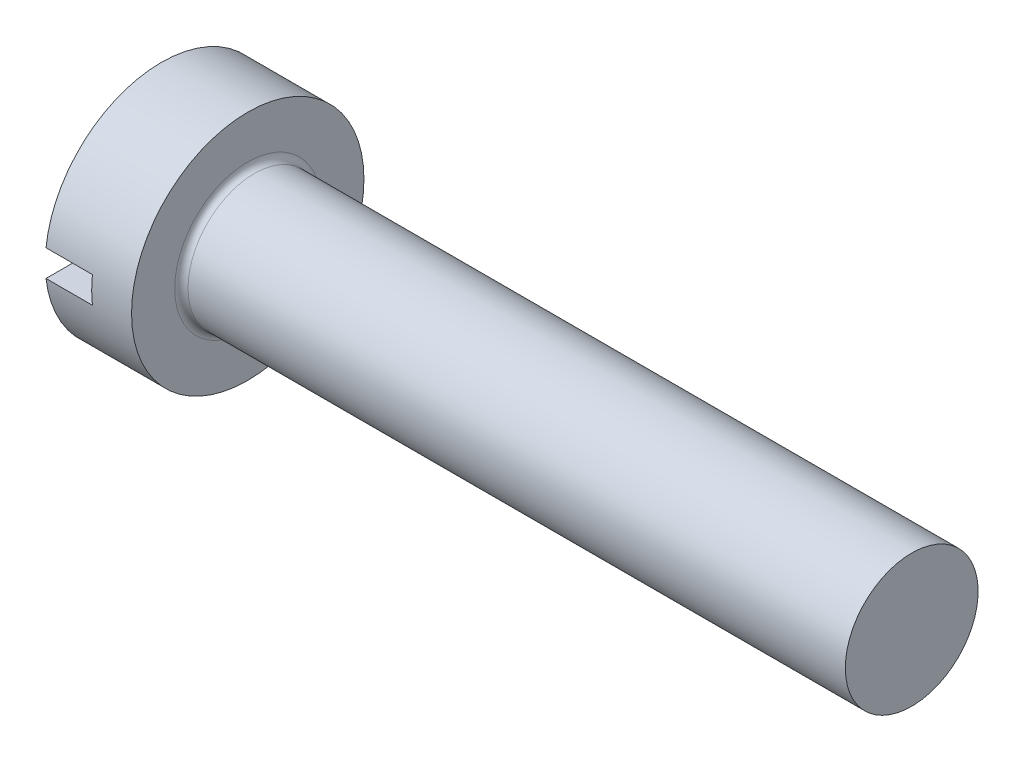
SolidWorks part; units mm, degrees
ref_plane "Front Plane" through (0, 0, 0) normal (0, 0, 1) x (1, 0, 0)
ref_plane "Top Plane" through (0, 0, 0) normal (0, 1, 0) x (1, 0, 0)
ref_plane "Right Plane" through (0, 0, 0) normal (1, 0, 0) x (0, 0, -1)
sketch "BodySke" plane through (0, 0, 0) normal (0, 0, 1) x (1, 0, 0)
  line L0 (0, 0) -> (120.5141, 0) construction
  line L1 (0, 0) -> (0, 50.5629) construction
  line L2 (5.2, 7) -> (5.2, 4)
  line L3 (5.2, 4) -> (45.2, 4)
  line L4 (45.2, 4) -> (45.2, 0)
  line L5 (0, 0) -> (45.2, 0)
  line L6 (5.2, 7) -> (0, 7)
  line L7 (6.45, 10.4217) -> (6.45, -3.1786) construction
  line L8 (15.2, 9.5609) -> (15.2, -6.7938) construction
  line L9 (0, 7) -> (0, 0)
  point P14 (45.2, 3.3095)
  dimension "Diameter" = 8
  dimension "Head_height" = 5.2
  dimension "Length" = 40
  dimension "Head_dia" = 14
  dimension "Advance" = 1.25
  dimension "Thread_length" = 30
  dimension "Thread_minor" = 6.619
revolve "BaseBody" add sketch "BodySke" angle 360 about L0
fillet "Fillet1" radius 0.4 1 edges at (5.2, 0, 4)
sketch "SlotSke" plane through (0, 0, 0) normal (1, 0, 0) x (0, 0, -1)
  line L1 (7, 0.8) -> (-7, 0.8)
  line L2 (7, 0.8) -> (7, -0.8)
  line L3 (7, -0.8) -> (-7, -0.8)
  line L4 (-7, 0.8) -> (-7, -0.8)
  dimension "D1" = 14
  dimension "D2" = 7
  dimension "Slot_width" = 1.6
  dimension "D4" = 0.8
extrude "Slot" cut sketch "SlotSke" along normal blind 2.8
sketch "ThdSchSke" plane through (0, 0, 0) normal (0, 0, 1) x (1, 0, 0)
  line L0 (0, 0) -> (54.7976, 0) construction
  line L1 (44.8013, 4.7973) -> (44.8013, 4)
  line L2 (44.8013, 4.7973) -> (45.5987, 4.7973)
  line L3 (45.5987, 4.7973) -> (45.5987, 4)
  line L4 (45.5987, 4) -> (45.2, 3.3095)
  line L5 (45.2, 3.3095) -> (44.8013, 4)
  line L6 (5.2, 4) -> (45.2, 4) construction
revolve "ThreadSchematic" [suppressed] cut sketch "ThdSchSke" angle 360 about L0
pattern_linear "ThdSchPat" [suppressed] count 24 along (1, 0, 0)
equation "\"Thread_minor@ThreadCosmetic\" = \"Thread_minor@BodySke\""
equation "\"D1@SlotSke\" = \"Head_dia@BodySke\""
equation "\"D2@SlotSke\" = \"D1@SlotSke\" / 2"
equation "\"D4@SlotSke\" = \"Slot_width@SlotSke\" / 2"
equation "\"Advance@ThdSchPat\" = \"Advance@BodySke\""
equation "\"D1@ThdSchPat\" =  int( \"Thread_length@BodySke\" / \"Advance@BodySke\" ) "
